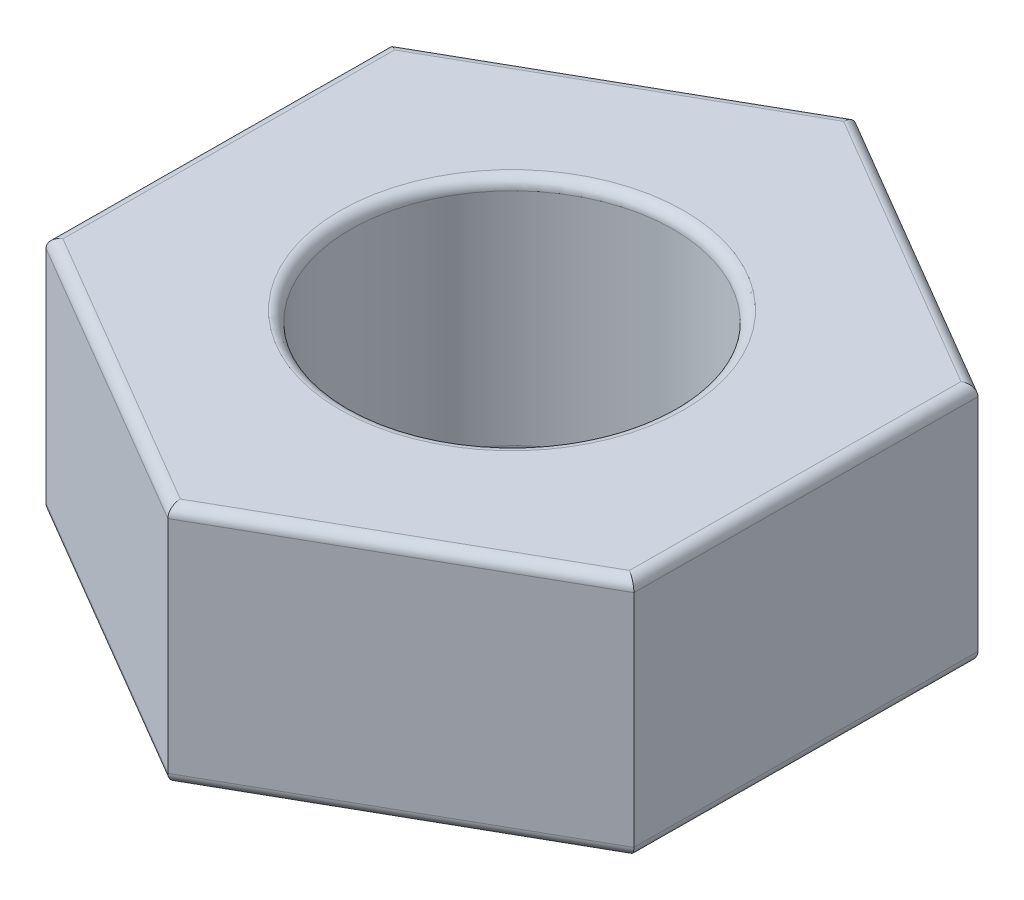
SolidWorks part; units mm, degrees
ref_plane "Front Plane" through (0, 0, 0) normal (0, 0, 1) x (1, 0, 0)
ref_plane "Top Plane" through (0, 0, 0) normal (0, 1, 0) x (1, 0, 0)
ref_plane "Right Plane" through (0, 0, 0) normal (1, 0, 0) x (0, 0, -1)
sketch "Sketch1" plane through (0, 0, 0) normal (0, 1, 0) x (1, 0, 0)
  line L1 (2.739, -1.6066) -> (2.7609, 1.5687)
  line L2 (2.7609, 1.5687) -> (0.0219, 3.1754)
  line L3 (0.0219, 3.1754) -> (-2.739, 1.6066)
  line L4 (-2.739, 1.6066) -> (-2.7609, -1.5687)
  line L5 (-2.7609, -1.5687) -> (-0.0219, -3.1754)
  line L6 (-0.0219, -3.1754) -> (2.739, -1.6066)
  circle A0 centre (0, 0) radius 2.75 construction
  circle A1 centre (0, 0) radius 1.5
  dimension "D1" = 5.5
  dimension "D2" = 3
extrude "Boss-Extrude1" add sketch "Sketch1" along normal blind 2.25
fillet "Fillet1" radius 0.1 14 edges at (0, 0, 1.5) (2.7499, 0, 0.0189) (1.3914, 0, -2.372) (-1.3586, 0, -2.391) (-2.7499, 0, -0.0189) (-1.3914, 0, 2.372) (1.3586, 0, 2.391) (0, 2.25, 1.5) (-1.3914, 2.25, 2.372) (-2.7499, 2.25, -0.0189) (-1.3586, 2.25, -2.391) (1.3914, 2.25, -2.372) (2.7499, 2.25, 0.0189) (1.3586, 2.25, 2.391)
